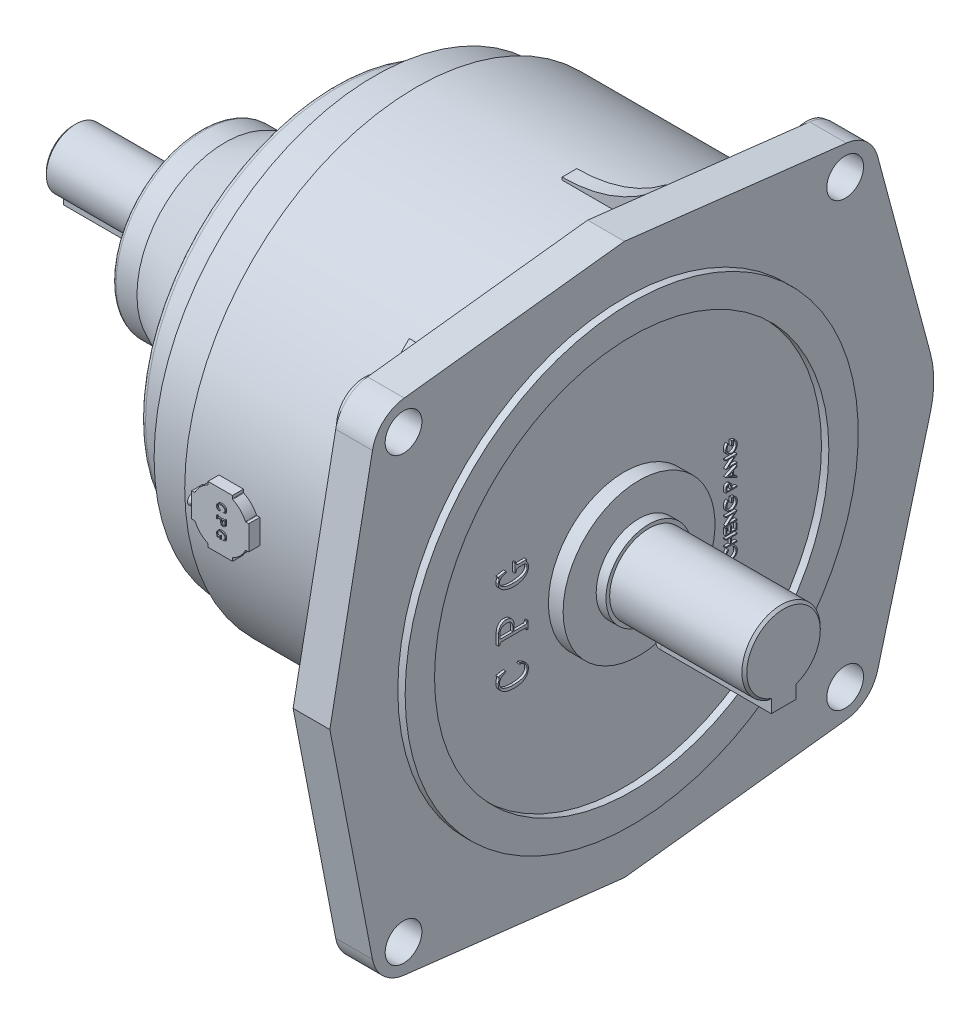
SolidWorks part; units mm, degrees
ref_plane "前视基准面" through (0, 0, 0) normal (0, 0, 1) x (1, 0, 0)
ref_plane "上视基准面" through (0, 0, 0) normal (0, 1, 0) x (1, 0, 0)
ref_plane "右视基准面" through (0, 0, 0) normal (1, 0, 0) x (0, 0, -1)
sketch "草图1" plane through (0, 0, 0) normal (0, 1, 0) x (1, 0, 0)
  line L0 (0, 0) -> (15.7361, 0) construction
  line L1 (0, 0) -> (0, -16)
  line L2 (0, -16) -> (-55, -16)
  line L3 (-55, -16) -> (-55, -17.5)
  line L4 (-55, -17.5) -> (-59, -17.5)
  line L5 (-62, -31) -> (-62, -92.5)
  line L6 (-62, -92.5) -> (-65, -92.5)
  line L7 (-65, -92.5) -> (-65, 0)
  line L8 (-65, 0) -> (0, 0)
  line L9 (-62, -31) -> (-59, -31)
  line L10 (-59, -31) -> (-59, -17.5)
  dimension "D1" = 55
  dimension "D2" = 32
  dimension "D3" = 35
  dimension "D4" = 3
  dimension "D5" = 185
  dimension "D6" = 65
  dimension "D7" = 3
  dimension "D8" = 62
revolve "旋转1" add sketch "草图1" angle 360 about L0
sketch "草图2" plane through (0, 0, 0) normal (0, 1, 0) x (1, 0, 0)
  line L0 (8.0167, 30) -> (-80, 30) construction
  line L4 (-80, 30) -> (-80, -64.5)
  line L5 (-80, -64.5) -> (-180, -64.5)
  line L6 (-180, -64.5) -> (-180, 30)
  line L11 (-80, 30) -> (-180, 30)
  dimension "D1" = 30
  dimension "D3" = 189
  dimension "D5" = 100
revolve "旋转2" add sketch "草图2" angle 360 about L0
sketch "草图12" plane through (-80, 0, 0) normal (1, 0, 0) x (0, 0, -1)
  line L0 (0, -112.5) -> (100.7627, -100.7627)
  line L1 (-100.7627, -100.7627) -> (0, -112.5)
  line L2 (-100.7627, -100.7627) -> (-120.238, 0)
  line L3 (-100.7627, 100.7627) -> (0, 112.5)
  line L4 (100.7627, -100.7627) -> (127.762, 0)
  line L5 (-120.238, 0) -> (-100.7627, 100.7627)
  line L6 (0, 112.5) -> (100.7627, 100.7627)
  line L7 (127.762, 0) -> (100.7627, 100.7627)
  line L8 (167.8979, 0) -> (-107.2143, 0) construction
  line L9 (0, 107.5085) -> (0, -103.3164) construction
  line L10 (0, 0) -> (-90.1561, 90.1561) construction
  line L11 (0, 0) -> (90.1561, 90.1561) construction
  circle A0 centre (0, 0) radius 127.5 construction
  circle A1 centre (-90.1561, 90.1561) radius 7.5
  circle A2 centre (90.1561, 90.1561) radius 7.5
  circle A3 centre (90.1561, -90.1561) radius 7.5
  circle A4 centre (-90.1561, -90.1561) radius 7.5
  dimension "D3" = 225
  dimension "D4" = 15
  dimension "D5" = 15
  dimension "D1" = 225
  dimension "D2" = 248
  dimension "D6" = 15
extrude "拉伸8" add sketch "草图12" along normal up to surface (15 mm away)
sketch "草图5" plane through (0, 0, 0) normal (0, 1, 0) x (1, 0, 0)
  line L0 (0, -5) -> (-45, -5)
  line L1 (0, -16) -> (0, 16) construction
  line L2 (-45, 5) -> (0, 5)
  line L3 (0, 5) -> (0, -5)
  line L4 (35.5, -13.7955) -> (35.5, 19.6443) construction
  arc A0 (-45, -5) -> (-45, 5) centre (-45, 0) cw
  dimension "D2" = 50
  dimension "D1" = 10
  dimension "D3" = 35.5
extrude "拉伸4" add sketch "草图5" against normal blind 19.5
fillet "圆角4" radius 15 4 edges at (-72.5, 100.7627, 100.7627) (-72.5, 100.7627, -100.7627) (-72.5, -100.7627, -100.7627) (-72.5, -100.7627, 100.7627)
fillet "圆角5" radius 40 1 edges at (-72.5, 0, -127.762)
chamfer "倒角1" distance 1 angle 45 1 edges at (0, 16, 0)
sketch "草图18" plane through (-80, 0, 0) normal (-1, 0, 0) x (0, 0, 1)
  line L0 (-30, 0) -> (73.8927, -103.8927) construction
  line L1 (0, -99) -> (0, 99) construction
  line L2 (89.8548, -102.0333) -> (0, -112.5) construction
  line L3 (36.8216, -66.8216) -> (73.8927, -103.8927)
  line L4 (-30, 0) -> (-90.1561, -90.1561) construction
  line L5 (-88.91, -87.0419) -> (-82.4506, -78.6078)
  line L7 (-30, 0) -> (-30, -109.0055) construction
  line L8 (0, -112.5) -> (-90.6456, -101.9412) construction
  line L9 (-30, -94.5) -> (-30, -109.0055)
  circle A0 centre (-30, 0) radius 94.5 construction
  arc A1 (-103.3989, -90.9242) -> (-90.6456, -101.9412) centre (-88.91, -87.0419) ccw construction
  circle A3 centre (-30, 0) radius 94.5 construction
  dimension "D1" = 45
  dimension "D2" = 10.6235
  dimension "D4" = 52.4264
  dimension "D5" = 14.5055
ref_plane "基准面7" through (-81, 0, 0) normal (1, 0, 0) x (0, 0, -1)
sketch "草图13" plane through (-80, 0, 0) normal (1, 0, 0) x (0, 0, -1)
  line L5 (0, 0) -> (107.7406, 0) construction
  circle A1 centre (90.1561, 90.1561) radius 11.6458
  circle A3 centre (90.1561, 90.1561) radius 7.5
  circle A4 centre (90.1561, -90.1561) radius 7.5 construction
  circle A5 centre (90.1561, -90.1561) radius 7.5
  circle A7 centre (-90.1561, -90.1561) radius 7.5
  arc A10 (90.6456, -101.9412) -> (103.3989, -90.9242) centre (88.91, -87.0419) ccw construction
  circle A11 centre (-90.1561, -90.1561) radius 7.5 construction
  arc A12 (-102.8467, -89.9806) -> (-89.8548, -102.0333) centre (-88.1192, -87.1341) ccw construction
  circle A14 centre (-90.1561, 90.1561) radius 7.5
  circle A15 centre (-90.1561, 90.1561) radius 11.3556
  circle A20 centre (-90.1561, -90.1561) radius 11.3556
  circle A21 centre (90.1561, -90.1561) radius 11.6458
  point P8 (30, 0)
extrude "拉伸9" add sketch "草图13" against normal up to surface (1 mm away)
sketch "草图14" plane through (0, 0, 0) normal (0, 1, 0) x (1, 0, 0)
  line L0 (-80, 30) -> (-180, 30) construction
  line L5 (-80, -89.8548) -> (-80, 0) construction
  line L6 (-117.4264, -64.5) -> (-117.4264, -65.5)
  line L7 (-80, -101.9264) -> (-81, -101.9264)
  line L9 (-80, -64.5) -> (-180, -64.5) construction
  arc A0 (-81, -101.9264) -> (-117.4264, -65.5) centre (-117.4264, -101.9264) ccw
  dimension "D1" = 131.9264
  dimension "D2" = 1
  dimension "D3" = 1
rib "筋17" sketch "草图14" sketch "草图14" thickness 6 extrusion direction parallel to sketch draft on no parameters "D1"=6
pattern_circular "阵列(圆周)16" count 8 over 360 about axis through (0, 0, -30) along (1, 0, 0) of "筋17"
ref_plane "基准面8" through (0, 0, -30) normal (0, 0, 1) x (1, 0, 0)
sketch "草图17" plane through (0, 0, -30) normal (0, 0, 1) x (1, 0, 0)
  line L0 (-80, -108.0055) -> (-81, -108.0055)
  line L1 (-80, -102.0333) -> (-80, -112.5) construction
  line L2 (-117.4264, -94.5) -> (-117.4264, -95.5)
  line L4 (-180, -94.5) -> (-80, -94.5) construction
  line L6 (-117.4264, -69.65) -> (-117.4264, -65.4074) construction
  arc A0 (-81, -108.0055) -> (-117.4264, -95.5) centre (-117.4264, -154.8049) ccw
  dimension "D1" = 13.5055
  dimension "D2" = 1
  dimension "D3" = 1
rib "筋24" sketch "草图17" sketch "草图17" thickness 6 extrusion direction parallel to sketch draft on no parameters "D1"=6
mirror "镜向1" about plane through (0, 0, 0) normal (0, 1, 0) of "筋24"
sketch "草圖1" plane through (0, 0, 0) normal (0, 1, 0) x (1, 0, 0)
  line L0 (-269.0797, 30) -> (-111.2984, 30) construction
  line L1 (-197, 30) -> (-320, 30)
  line L2 (-197.5, 109) -> (-211.5, 109)
  line L3 (-320, 41) -> (-319, 42)
  line L5 (-213.5, 86.5) -> (-258, 66)
  line L6 (-271.5, 42) -> (-271.5, 41.95)
  line L9 (-266.5, 66) -> (-258, 66)
  line L10 (-213.5, 107) -> (-213.5, 86.5)
  line L11 (-271.5, 42) -> (-319, 42)
  line L12 (-270, 41.95) -> (-271.5, 41.95)
  line L13 (-269.5, 43.75) -> (-270, 43.45)
  line L14 (-320, 30) -> (-320, 41)
  line L16 (-268, 43.75) -> (-269.5, 43.75)
  line L18 (-197, 108.5) -> (-197, 30)
  line L19 (-270, 43.45) -> (-270, 41.95)
  line L20 (-268, 43.75) -> (-268, 64.5)
  arc A0 (-197, 108.5) -> (-197.5, 109) centre (-197.5, 108.5) ccw
  arc A1 (-197, 108.5) -> (-197.5, 109) centre (-197.5, 108.5) ccw
  arc A2 (-266.5, 66) -> (-268, 64.5) centre (-266.5, 64.5) ccw
  arc A3 (-211.5, 109) -> (-213.5, 107) centre (-211.5, 107) ccw
  point P19 (-320, 42)
  dimension "D6" = 320
  dimension "D1" = 30
  dimension "D2" = 24
  dimension "D3" = 50
  dimension "D4" = 72
  dimension "D5" = 158
sketch "草圖2" plane through (-180, 0, 0) normal (-1, 0, 0) x (0, 0, 1)
  line L0 (-108.5, 0) -> (-30, 0) construction
  circle A0 centre (-30, 0) radius 90
  dimension "D1" = 180
extrude "伸長1" add sketch "草圖2" along normal blind 17
revolve "旋轉1" add sketch "草圖1" angle 360 about L0
ref_plane "平面1" through (0, 0, -30) normal (0, 0, 1) x (1, 0, 0)
sketch "草圖4" plane through (-62, 0, 0) normal (1, 0, 0) x (0, 0, -1)
  circle A0 centre (0, 0) radius 80.5
  circle A1 centre (0, 0) radius 31 construction
  circle A2 centre (0, 0) radius 31
  dimension "D1" = 161
extrude "伸長3" cut sketch "草圖4" against normal blind 3
sketch "草圖5"
  dimension "D1" = 80
  dimension "D2" = 80
  dimension "D3" = 40
  dimension "D4" = 45
  dimension "D5" = 40
extrude "伸長4" add sketch "草圖5" along normal blind 1
sketch "草圖6" plane through (0, 0, 0) normal (0, 1, 0) x (1, 0, 0)
  line L0 (-365.6412, 30) -> (-251.7861, 30) construction
  line L1 (-320, 26) -> (-279, 26)
  line L2 (-320, 41) -> (-320, 19) construction
  line L3 (-279, 34) -> (-320, 34)
  line L4 (-320, 34) -> (-320, 26)
  line L5 (-275, 30) -> (-275, 11.8612) construction
  line L6 (-347.1, 30) -> (-347.1, 0) construction
  arc A0 (-279, 26) -> (-279, 34) centre (-279, 30) ccw
  dimension "D1" = 12
  dimension "D2" = 8
  dimension "D3" = 4
  dimension "D4" = 45
  dimension "D5" = 27.1
extrude "伸長5" add sketch "草圖6" against normal blind 15.1
ref_plane "平面2" through (0, 0, 69) normal (0, 0, 1) x (1, 0, 0)
sketch "草圖7" plane through (0, 0, 69) normal (0, 0, 1) x (1, 0, 0)
  line L0 (-166, 11.65) -> (-156, 11.65)
  line L1 (-166, 11.65) -> (-166, 10.5119)
  line L2 (-156, 11.65) -> (-156, 10.5119)
  line L3 (-166, -10.5119) -> (-166, -11.65)
  line L4 (-156, -10.5119) -> (-156, -11.65)
  line L5 (-172.65, 5) -> (-171.5119, 5)
  line L6 (-172.65, -5) -> (-171.5119, -5)
  line L7 (-172.65, -5) -> (-172.65, 5)
  line L8 (-166, -11.65) -> (-166, -10.5119)
  line L9 (-156, -11.65) -> (-156, -10.5119)
  line L10 (-156, -11.65) -> (-166, -11.65)
  line L11 (-149.35, -5) -> (-150.4881, -5)
  line L12 (-149.35, 5) -> (-150.4881, 5)
  line L13 (-149.35, 5) -> (-149.35, -5)
  arc A0 (-166.1383, 10.2882) -> (-171.2882, 5.1383) centre (-161, 0) ccw
  arc A1 (-166.1383, 10.2882) -> (-166, 10.5119) centre (-166.25, 10.5119) ccw
  arc A2 (-156, 10.5119) -> (-155.8617, 10.2882) centre (-155.75, 10.5119) ccw
  arc A3 (-171.5119, 5) -> (-171.2882, 5.1383) centre (-171.5119, 5.25) ccw
  arc A4 (-171.2882, -5.1383) -> (-171.5119, -5) centre (-171.5119, -5.25) ccw
  arc A5 (-166, -10.5119) -> (-166.1383, -10.2882) centre (-166.25, -10.5119) ccw
  arc A6 (-155.8617, -10.2882) -> (-156, -10.5119) centre (-155.75, -10.5119) ccw
  arc A7 (-150.4881, -5) -> (-150.7118, -5.1383) centre (-150.4881, -5.25) ccw
  arc A8 (-150.7118, 5.1383) -> (-150.4881, 5) centre (-150.4881, 5.25) ccw
  arc A9 (-150.7118, 5.1383) -> (-155.8617, 10.2882) centre (-161, 0) ccw
  arc A10 (-171.2882, -5.1383) -> (-166.1383, -10.2882) centre (-161, 0) ccw
  arc A11 (-155.8617, -10.2882) -> (-150.7118, -5.1383) centre (-161, 0) ccw
extrude "伸長6" add sketch "草圖7" against normal blind 4.5 separate body contours A6 A11 A7 L11 L13 L12 A8 A9 A2 L2 L0 L1 A1 A0 A3 L5 L7 L6 A4 A10 A5 L3 L10 L4
sketch "草圖8"
extrude "伸長7" add sketch "草圖8" along normal blind 0.5
sketch "草圖9" plane through (0, 0, 0) normal (0, 1, 0) x (1, 0, 0)
  line L0 (-174.6144, -66.75) -> (-166.6144, -66.75)
  line L1 (-174.6144, -66.75) -> (-174.6144, -64.75)
  line L2 (-173.1144, -65.5) -> (-173.1144, -64.75)
  line L13 (-171.1144, -65.5) -> (-166.6144, -65.75)
  line L15 (-173.1144, -65.5) -> (-171.1144, -65.5)
  line L23 (-174.6144, -64.75) -> (-173.1144, -64.75)
  line L24 (-171.1144, -66.75) -> (-171.1144, -65.5)
  line L25 (-166.6144, -66.75) -> (-166.6144, -65.75)
revolve "旋轉2" add sketch "草圖9" angle 360 about L0
equation "\"D3@草图1\" = \"D2@草图1\"+3"
equation "\"D5@草图1\" = \"D1@草圖4\"+24"
equation "\"D1@拉伸4\" = \"D3@草图5\"-\"D2@草图1\"/2"
equation "\"D1@伸長5\" = \"D5@草圖6\"-\"D2@草圖1\"/2"
